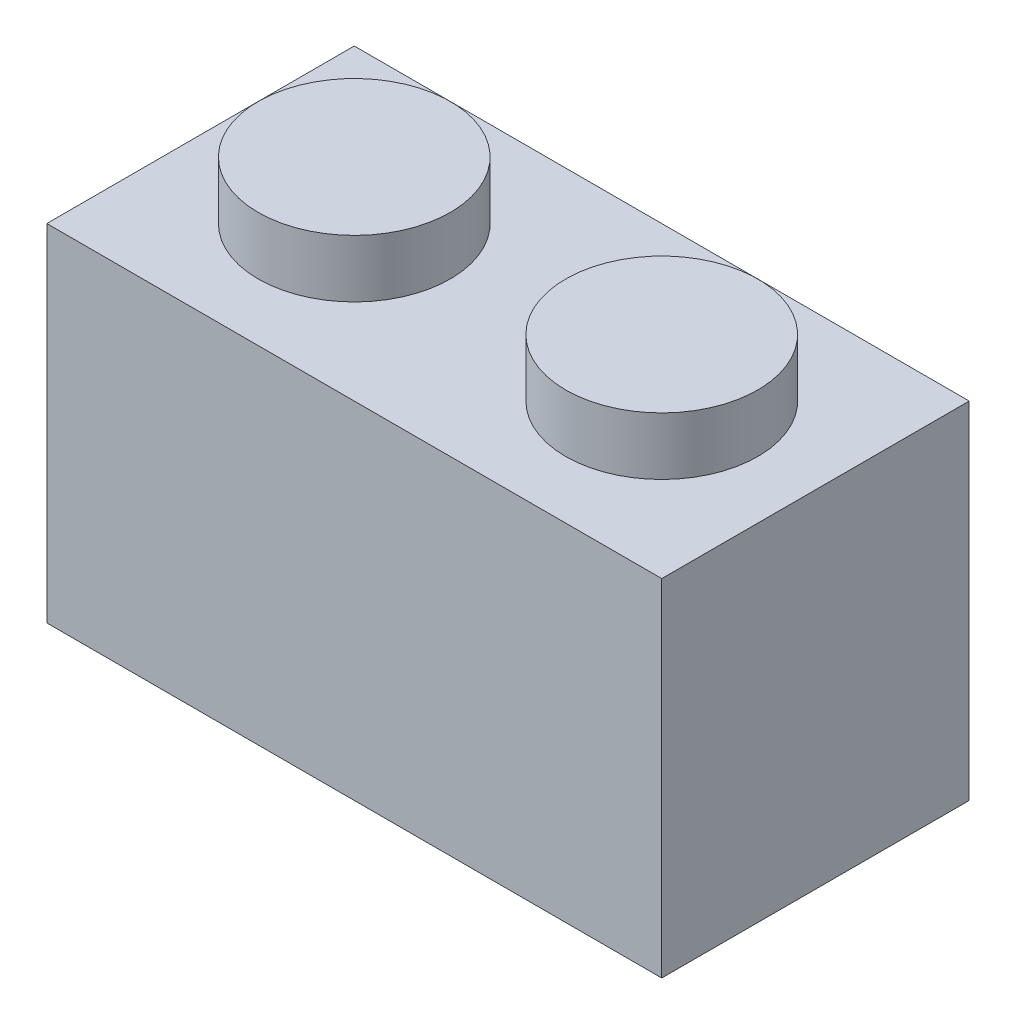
SolidWorks part; units mm, degrees
ref_plane "Face" through (0, 0, 0) normal (0, 0, 1) x (1, 0, 0)
ref_plane "Dessus" through (0, 0, 0) normal (0, 1, 0) x (1, 0, 0)
ref_plane "Droite" through (0, 0, 0) normal (1, 0, 0) x (0, 0, -1)
sketch "Esquisse1" plane through (0, 0, 0) normal (0, 1, 0) x (1, 0, 0)
  line L1 (0, 0) -> (16, 0)
  line L2 (0, 0) -> (0, -8)
  line L3 (0, -8) -> (16, -8)
  line L4 (16, 0) -> (16, -8)
  dimension "D1" = 16
  dimension "D2" = 8
extrude "Extrusion1" add sketch "Esquisse1" against normal blind 1
sketch "Esquisse2" plane through (0, -1, 0) normal (0, -1, 0) x (1, 0, 0)
  line L1 (16, 8) -> (0, 8)
  line L2 (16, 8) -> (16, 0)
  line L3 (16, 0) -> (0, 0)
  line L4 (0, 8) -> (0, 0)
  line L5 (1, 1) -> (15, 1)
  line L6 (1, 1) -> (1, 7)
  line L7 (1, 7) -> (15, 7)
  line L8 (15, 1) -> (15, 7)
  dimension "D1" = 1
  dimension "D2" = 1
  dimension "D3" = 1
  dimension "D4" = 1
extrude "Extrusion4" add sketch "Esquisse2" along normal blind 8
sketch "Esquisse3" plane through (0, -1, 0) normal (0, -1, 0) x (1, 0, 0)
  line L0 (0, 0) -> (16, 0) construction
  line L1 (16, 0) -> (16, 8) construction
  circle A0 centre (8, 4) radius 1.5
  dimension "D1" = 3
  dimension "D2" = 4
  dimension "D3" = 8
extrude "Extrusion5" add sketch "Esquisse3" along normal blind 8
sketch "Esquisse4" plane through (0, 0, 0) normal (0, 1, 0) x (-1, 0, 0)
  line L0 (-16, 0) -> (0, 0) construction
  line L1 (-16, 8) -> (-16, 0) construction
  line L2 (0, 0) -> (0, 8) construction
  circle A0 centre (-12, 4) radius 2.5
  circle A1 centre (-4, 4) radius 2.5
  dimension "D3" = 5
  dimension "D4" = 5
  dimension "D1" = 4
  dimension "D2" = 4
  dimension "D5" = 4
extrude "Extrusion6" add sketch "Esquisse4" along normal blind 1.5
